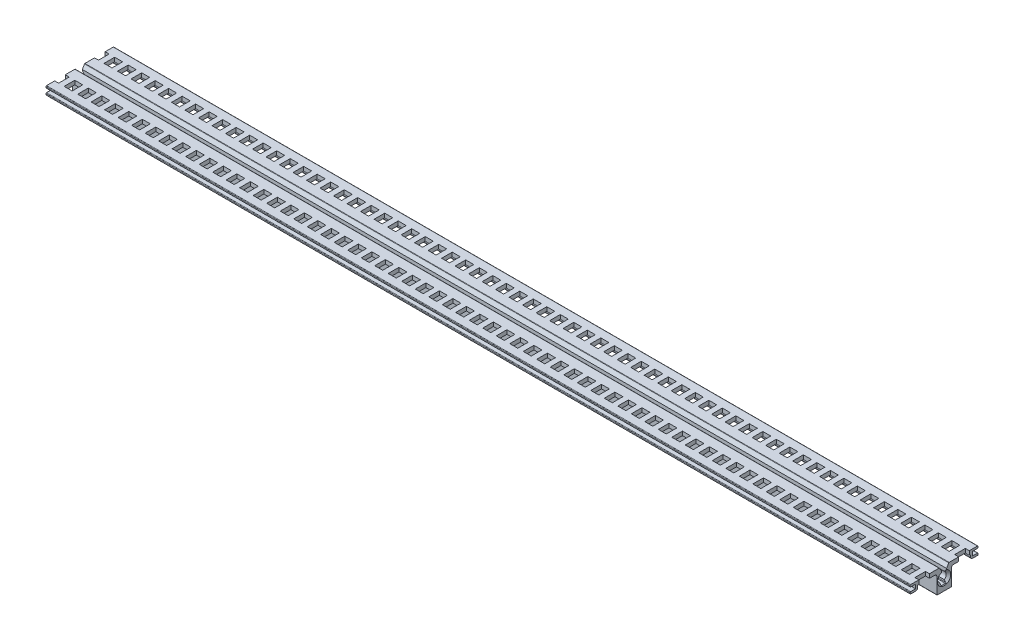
SolidWorks part; units mm, degrees
other "34561584"
ref_plane "前视基准面" through (0, 0, 0) normal (0, 0, 1) x (1, 0, 0)
ref_plane "上视基准面" through (0, 0, 0) normal (0, 1, 0) x (1, 0, 0)
ref_plane "右视基准面" through (0, 0, 0) normal (1, 0, 0) x (0, 0, -1)
imported_body "输入1"
sketch "草图1" plane through (0, 0, 10.25) normal (0, 0, 1) x (1, 0, 0)
  line L0 (-215.9, -2.3) -> (-215.9, -8.2) construction
  line L1 (215.9, 10.218) -> (109.22, 10.218)
  line L2 (215.9, 10.218) -> (215.9, -17.1182)
  line L3 (215.9, -17.1182) -> (109.22, -17.1182)
  line L4 (109.22, 10.218) -> (109.22, -17.1182)
  line L5 (215.9, -2.3) -> (215.9, -8.2) construction
  dimension "D1" = 325.12
extrude "切除-拉伸1" cut sketch "草图1" against normal mid plane 41
sketch "草图2" plane through (109.22, 0, 0) normal (1, 0, 0) x (0, 0, -1)
  circle A0 centre (-7.5, -4.2) radius 1.65
extrude "切除-拉伸2" cut sketch "草图2" against normal blind 15.02
chamfer "倒角1" distance 0.85 angle 45 1 edges at (109.22, -4.2, 9.15)
